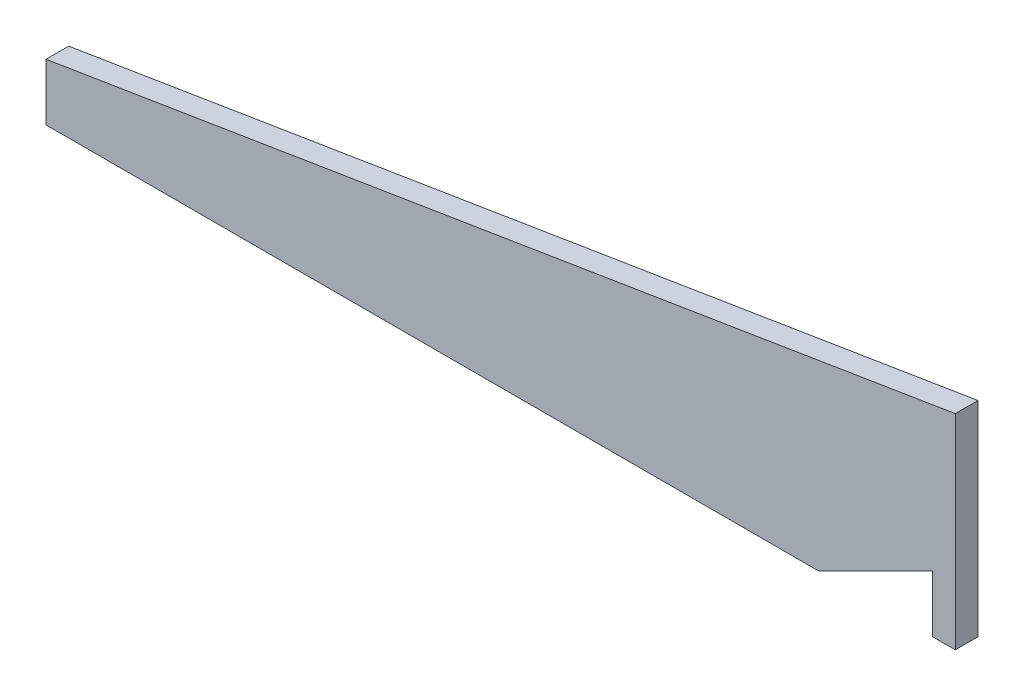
SolidWorks part; units mm, degrees
ref_plane "Front Plane" through (0, 0, 0) normal (0, 0, 1) x (1, 0, 0)
ref_plane "Top Plane" through (0, 0, 0) normal (0, 1, 0) x (1, 0, 0)
ref_plane "Right Plane" through (0, 0, 0) normal (1, 0, 0) x (0, 0, -1)
sketch "Sketch1" plane through (0, 0, 0) normal (0, 0, 1) x (1, 0, 0)
  line L0 (-31.5105, 0) -> (48.4895, 0)
  line L1 (-31.5105, 0) -> (-31.5105, 5)
  line L2 (-31.5105, 5) -> (48.4895, 18)
  line L3 (48.4895, 18) -> (48.4895, 0)
  line L4 (36.4895, 0) -> (46.4895, 5)
  line L5 (46.4895, 5) -> (46.4895, 0)
  dimension "D1" = 80
  dimension "D2" = 5
  dimension "D3" = 18
  dimension "D4" = 5
  dimension "D5" = 2
  dimension "D6" = 10
extrude "Boss-Extrude1" add sketch "Sketch1" along normal blind 2 contours L4 L5 L0 L3 L2 L1
